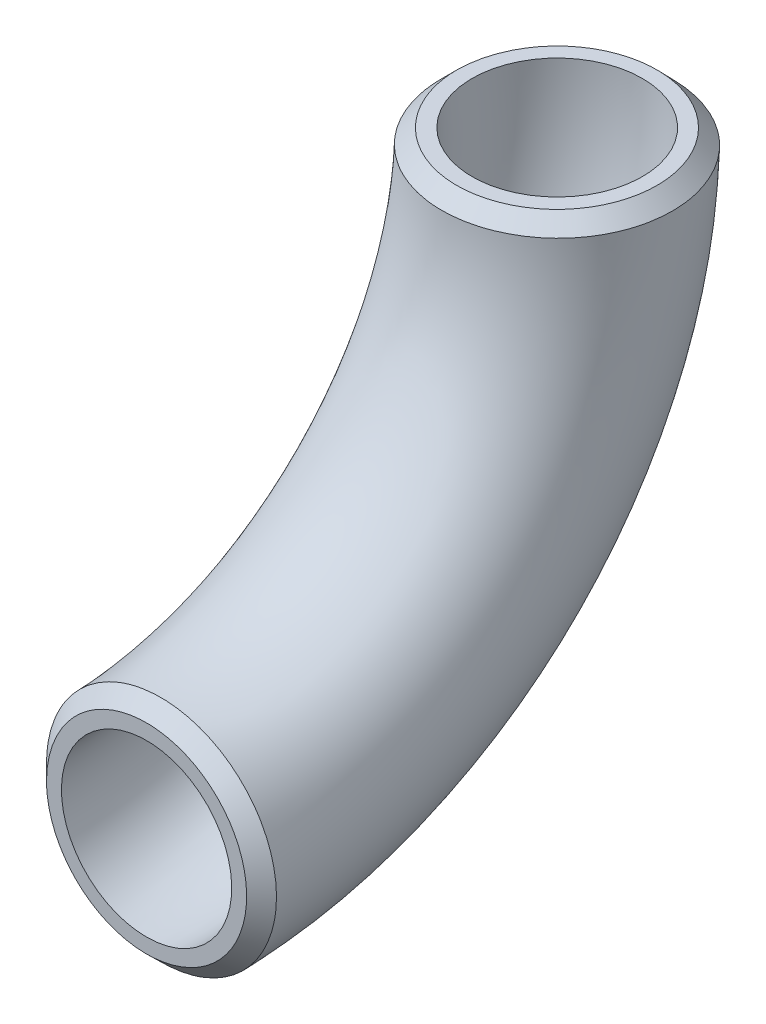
SolidWorks part; units mm, degrees
ref_plane "Front" through (0, 0, 0) normal (0, 0, 1) x (1, 0, 0)
ref_plane "Top" through (0, 0, 0) normal (0, 1, 0) x (1, 0, 0)
ref_plane "Right" through (0, 0, 0) normal (1, 0, 0) x (0, 0, -1)
sketch "Sketch1" plane through (0, 0, 0) normal (1, 0, 0) x (0, 0, -1)
  line L0 (0, 0) -> (38.1, 0) construction
  line L1 (38.1, 0) -> (38.1, 38.1) construction
  line L2 (0, 7.8994) -> (0, -7.8994) construction
  line L3 (0, 10.668) -> (0, -10.668) construction
  arc A0 (0, 0) -> (38.1, 38.1) centre (0, 38.1) ccw
sketch "Sketch2" plane through (0, 28.575, 0) normal (0, 0, -1) x (-1, 0, 0)
  circle A0 centre (0, -28.575) radius 7.8994
  circle A1 centre (0, -28.575) radius 10.668
sweep "Sweep1" add profiles "Sketch2" path "Sketch1"
chamfer "Chamfer1" distance 1.3843 angle 45 2 edges at (-10.668, 38.1, -38.1) (-10.668, 0, 0)
equation "\"D1@Chamfer1\" = \"T@Sketch1\" / 2"
